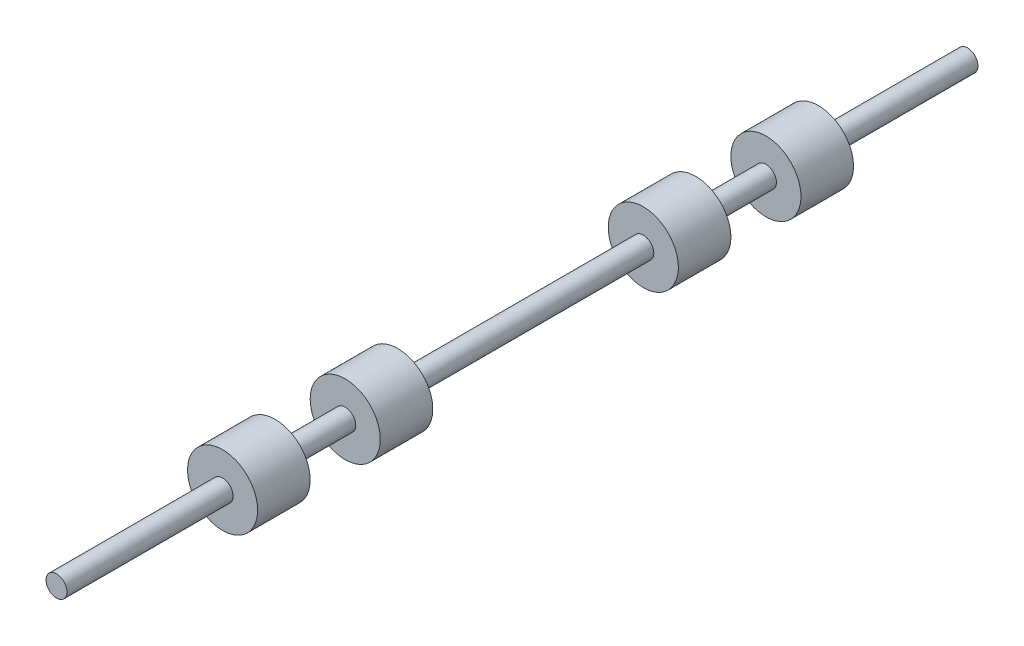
SolidWorks part; units mm, degrees
ref_plane "正面" through (0, 0, 0) normal (0, 0, 1) x (1, 0, 0)
ref_plane "平面" through (0, 0, 0) normal (0, 1, 0) x (1, 0, 0)
ref_plane "右側面" through (0, 0, 0) normal (1, 0, 0) x (0, 0, -1)
sketch "ｽｹｯﾁ1" plane through (0, 0, 0) normal (0, 0, 1) x (1, 0, 0)
  circle A0 centre (0, 0) radius 0.3
  dimension "D1" = 0.6
extrude "ﾎﾞｽ - 押し出し1" add sketch "ｽｹｯﾁ1" along normal blind 26
sketch "ｽｹｯﾁ2" plane through (0, 0, 0) normal (0, 1, 0) x (1, 0, 0)
  line L0 (0, 0) -> (0, -26) construction
  line L1 (-0.3, -26) -> (0.3, -26) construction
  line L2 (0, -6.753) -> (2.1727, -6.753) construction
  line L3 (0, -4.253) -> (1, -4.253)
  line L4 (0, -4.253) -> (0, -5.753)
  line L5 (0, -5.753) -> (1, -5.753)
  line L6 (1, -4.253) -> (1, -5.753)
  line L7 (0, -4.253) -> (1, -5.753) construction
  line L8 (0, -5.753) -> (1, -4.253) construction
  line L9 (0, -7.753) -> (1, -7.753)
  line L10 (0, -7.753) -> (0, -9.253)
  line L11 (0, -9.253) -> (1, -9.253)
  line L12 (1, -7.753) -> (1, -9.253)
  line L13 (0, -7.753) -> (1, -9.253) construction
  line L14 (0, -9.253) -> (1, -7.753) construction
  line L15 (0, -18.76) -> (5.571, -18.76) construction
  line L16 (0, -16.26) -> (1, -16.26)
  line L17 (0, -16.26) -> (0, -17.76)
  line L18 (0, -17.76) -> (1, -17.76)
  line L19 (1, -16.26) -> (1, -17.76)
  line L20 (0, -16.26) -> (1, -17.76) construction
  line L21 (0, -17.76) -> (1, -16.26) construction
  line L22 (0, -19.76) -> (1, -19.76)
  line L23 (0, -19.76) -> (0, -21.26)
  line L24 (0, -21.26) -> (1, -21.26)
  line L25 (1, -19.76) -> (1, -21.26)
  line L26 (0, -19.76) -> (1, -21.26) construction
  line L27 (0, -21.26) -> (1, -19.76) construction
  point P9 (0.5, -5.003)
  point P14 (0.5, -8.503)
  point P21 (0.5, -17.01)
  point P26 (0.5, -20.51)
  dimension "D1" = 1.5
  dimension "D2" = 1.5
  dimension "D3" = 1
  dimension "D4" = 1
  dimension "D5" = 2
  dimension "D6" = 1
  dimension "D7" = 1
  dimension "D8" = 1.5
  dimension "D9" = 1.5
  dimension "D10" = 2
  dimension "D11" = 12.007
  dimension "D12" = 7.24
revolve "回転1" add sketch "ｽｹｯﾁ2" angle 360 about L0
